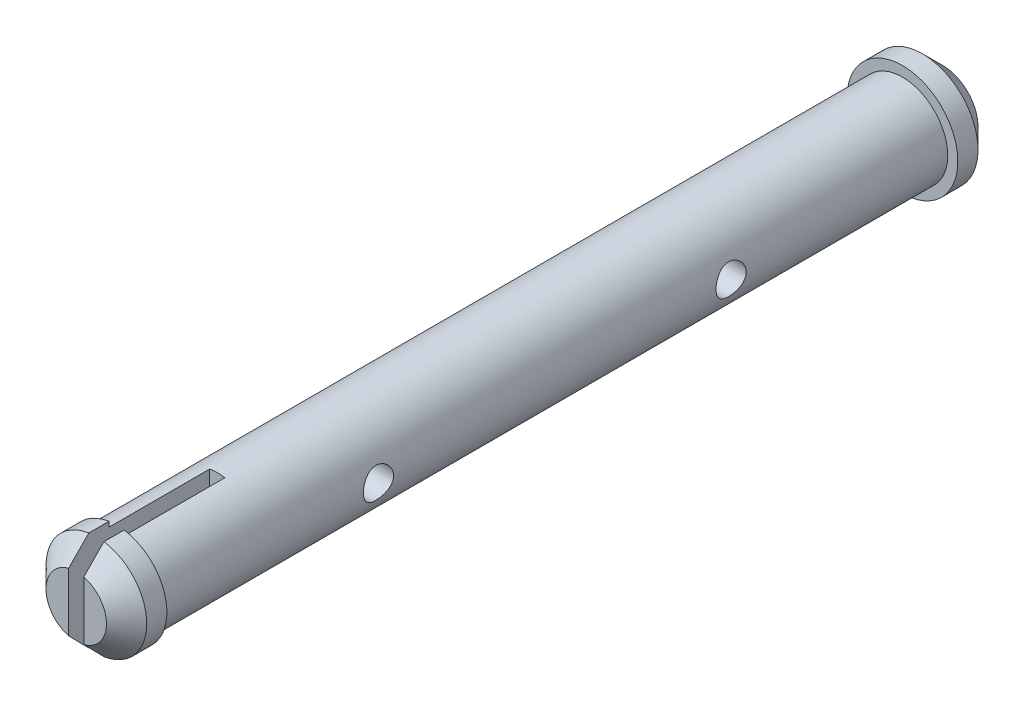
SolidWorks part; units mm, degrees
ref_plane "Alzado" through (0, 0, 0) normal (0, 0, 1) x (1, 0, 0)
ref_plane "Planta" through (0, 0, 0) normal (0, 1, 0) x (1, 0, 0)
ref_plane "Vista lateral" through (0, 0, 0) normal (1, 0, 0) x (0, 0, -1)
sketch "Croquis1" plane through (0, 0, 0) normal (0, 0, 1) x (1, 0, 0)
  circle A0 centre (0, 0) radius 4.5
  dimension "D1" = 9
extrude "Saliente-Extruir1" add sketch "Croquis1" along normal blind 78
sketch "Croquis2" plane through (0, 0, 0) normal (0, 0, -1) x (-1, 0, 0)
  circle A0 centre (0, 0) radius 5.5
  dimension "D1" = 11
extrude "Saliente-Extruir2" add sketch "Croquis2" along normal blind 4
sketch "Croquis3" plane through (0, 0, 78) normal (0, 0, 1) x (1, 0, 0)
  circle A0 centre (0, 0) radius 5
  dimension "D1" = 10
extrude "Saliente-Extruir3" add sketch "Croquis3" along normal blind 4
sketch "Croquis4" plane through (0, 0, 82) normal (0, 0, 1) x (1, 0, 0)
  line L1 (-0.75, 5.1171) -> (0.75, 5.1171)
  line L2 (-0.75, 5.1171) -> (-0.75, -5.2458)
  line L3 (-0.75, -5.2458) -> (0.75, -5.2458)
  line L4 (0.75, 5.1171) -> (0.75, -5.2458)
  point P4 (0, -5.2458)
  dimension "D1" = 1.5
extrude "Cortar-Extruir1" cut sketch "Croquis4" against normal blind 14
chamfer "Chaflán1" distance 2 angle 45 3 edges at (-5.5, 0, -4) (-5, 0, 82) (5, 0, 82)
sketch "Croquis5" plane through (0, 0, 0) normal (1, 0, 0) x (0, 0, -1)
  line L5 (0, 5.5) -> (0, -5.5) construction
  line L6 (-78, -4.4371) -> (-78, 4.4371) construction
  circle A0 centre (-21.5, 0) radius 1.5
  circle A1 centre (-56.5, 0) radius 1.5
  dimension "D2" = 3
  dimension "D3" = 3
  dimension "D1" = 21.5
  dimension "D4" = 21.5
extrude "Cortar-Extruir2" cut sketch "Croquis5" against normal through all both and the other way through all
